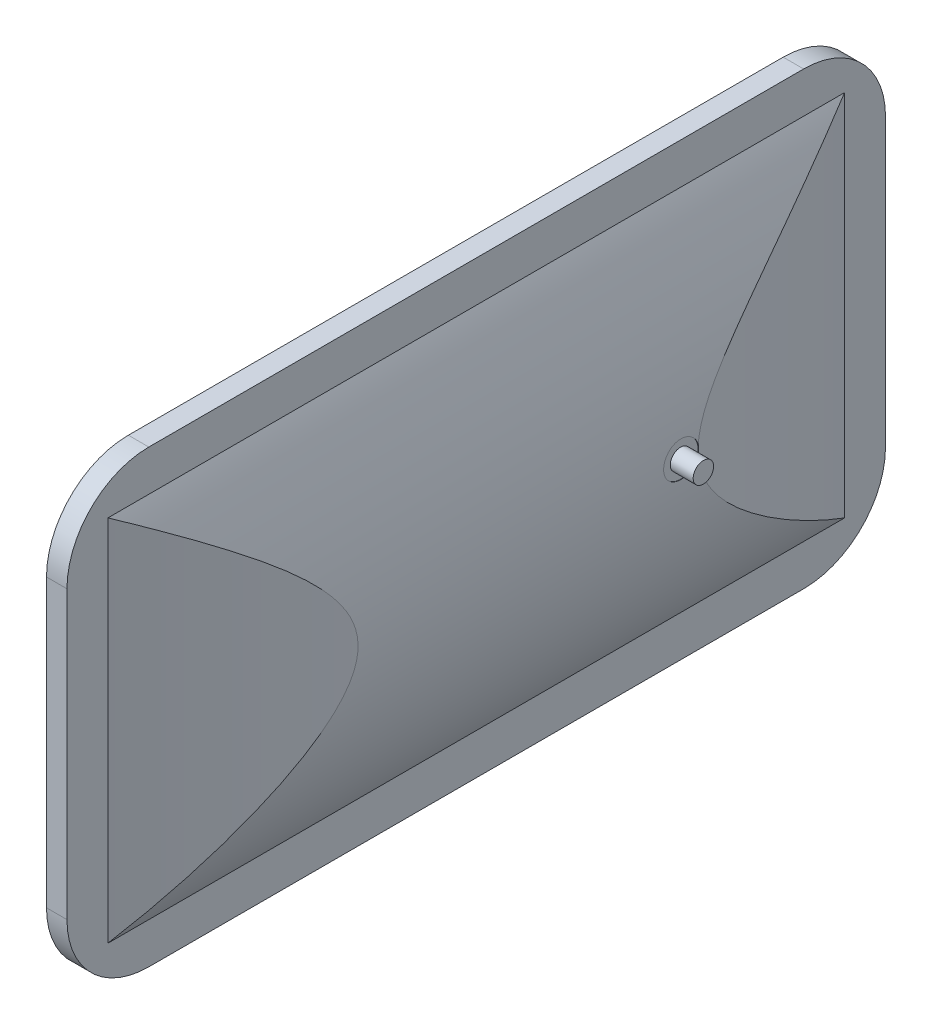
SolidWorks part; units mm, degrees
ref_plane "Plane1" through (0, 0, 0) normal (0, 0, 1) x (1, 0, 0)
ref_plane "Plane2" through (0, 0, 0) normal (0, 1, 0) x (1, 0, 0)
ref_plane "Plane3" through (0, 0, 0) normal (1, 0, 0) x (0, 0, -1)
sketch "Sketch1" plane through (0, 0, 0) normal (0, 0, 1) x (1, 0, 0)
  line L0 (0, 139.7) -> (0, 0) construction
  line L1 (-3.175, 0) -> (-3.175, 12.7)
  line L2 (-3.175, 139.7) -> (3.175, 139.7)
  line L3 (-3.175, 139.7) -> (-3.175, 127)
  line L4 (3.175, 139.7) -> (3.175, 127)
  line L5 (-3.175, 0) -> (3.175, 0)
  line L8 (3.175, 0) -> (3.175, 12.7)
  arc A0 (3.175, 127) -> (3.175, 12.7) centre (-90.1805, 69.85) cw
  arc A1 (-3.175, 127) -> (-3.175, 12.7) centre (90.1805, 69.85) ccw
extrude "Base-Extrude" add sketch "Sketch1" along normal blind 254
sketch "Sketch2" plane through (0, 139.7, 0) normal (0, 1, 0) x (-1, 0, 0)
  line L0 (3.175, 0) -> (-3.175, 0)
  line L1 (-3.175, 0) -> (-3.175, 12.7)
  line L2 (-3.175, 254) -> (-3.175, 0) construction
  line L3 (-3.175, 254) -> (3.175, 254)
  line L4 (-3.175, 254) -> (3.175, 254) construction
  line L5 (-3.175, 254) -> (-3.175, 241.3)
  line L6 (0, 0) -> (0, 254) construction
  line L7 (3.175, 254) -> (3.175, 241.3)
  line L8 (3.175, 0) -> (3.175, 12.7)
  arc A0 (-3.175, 241.3) -> (-3.175, 12.7) centre (307.9518, 127) ccw
  arc A1 (3.175, 241.3) -> (3.175, 12.7) centre (-307.9518, 127) cw
  dimension "D1" = 12.7
  dimension "D2" = 12.7
extrude "Cut-Extrude1" cut sketch "Sketch2" against normal through all flip side to cut
sketch "Sketch3" plane through (3.175, 0, 0) normal (1, 0, 0) x (0, 0, -1)
  line L0 (0, 0) -> (0, 139.7) construction
  line L2 (-307.0721, 69.85) -> (-147.8557, 69.85) construction
  circle A0 centre (-79.4972, 69.85) radius 5.461
  dimension "D2" = 10.922
  dimension "D1" = 79.4972
extrude "Cut-Extrude2" cut sketch "Sketch3" along normal up to next
fillet "Fillet1" radius 25.4
sketch "Sketch4" plane through (0, 0, 0) normal (1, 0, 0) x (0, 0, -1)
  circle A0 centre (-79.4972, 69.85) radius 5.461
  dimension "D1" = 10.922
extrude "Boss-Extrude1" add sketch "Sketch4" along normal blind 19.05
sketch "Sketch5" plane through (19.05, 0, 0) normal (1, 0, 0) x (0, 0, -1)
  circle A0 centre (-79.4972, 69.85) radius 3.175
  dimension "D1" = 6.35
extrude "Boss-Extrude2" add sketch "Sketch5" along normal blind 7.112
